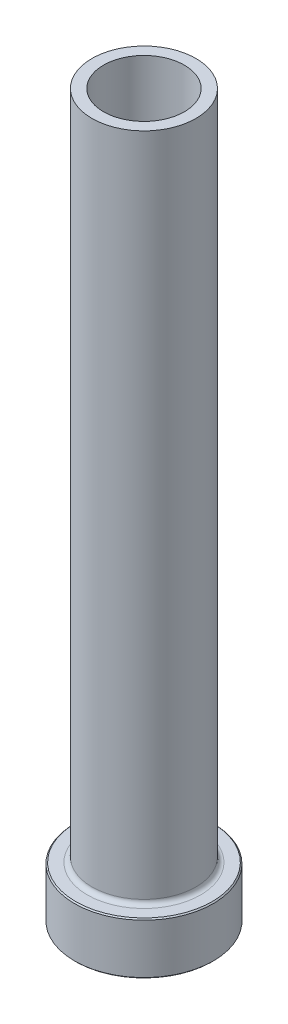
SolidWorks part; units mm, degrees
ref_plane "Front Plane" through (0, 0, 0) normal (0, 0, 1) x (1, 0, 0)
ref_plane "Top Plane" through (0, 0, 0) normal (0, 1, 0) x (1, 0, 0)
ref_plane "Right Plane" through (0, 0, 0) normal (1, 0, 0) x (0, 0, -1)
sketch "Sketch1" plane through (0, 0, 0) normal (0, 0, 1) x (1, 0, 0)
  line L0 (-7, 125) -> (-9, 125)
  line L1 (-9, 125) -> (-9, 9)
  line L2 (-9, 9) -> (-12, 9)
  line L3 (-12, 9) -> (-12, 0)
  line L4 (13.2, 0) -> (-13.2, 0) construction
  line L5 (-12, 0) -> (-7.25, 0)
  line L6 (-7, 70) -> (-7, 125)
  line L7 (0, 92.1877) -> (0, -15.5353) construction
  line L8 (0, -13.2) -> (0, 13.2) construction
  line L9 (-7, 70) -> (-7.25, 58)
  line L10 (-7.25, 58) -> (-7.25, 0)
  dimension "D1" = 0.25
  dimension "ID" = 14
  dimension "OD" = 18
  dimension "L" = 125
  dimension "H" = 24
  dimension "T" = 9
  dimension "N" = 55
  dimension "D2" = 12
revolve "Revolve1" add sketch "Sketch1" angle 360 about L7
fillet "Fillet1" radius 0.8 1 edges at (0, 9, 9)
chamfer "Chamfer1" distance 0.2 angle 45 2 edges at (0, 9, 12) (0, 0, 12)
chamfer "Chamfer3" distance 0.5 angle 45 1 edges at (0, 0, 7.25)
